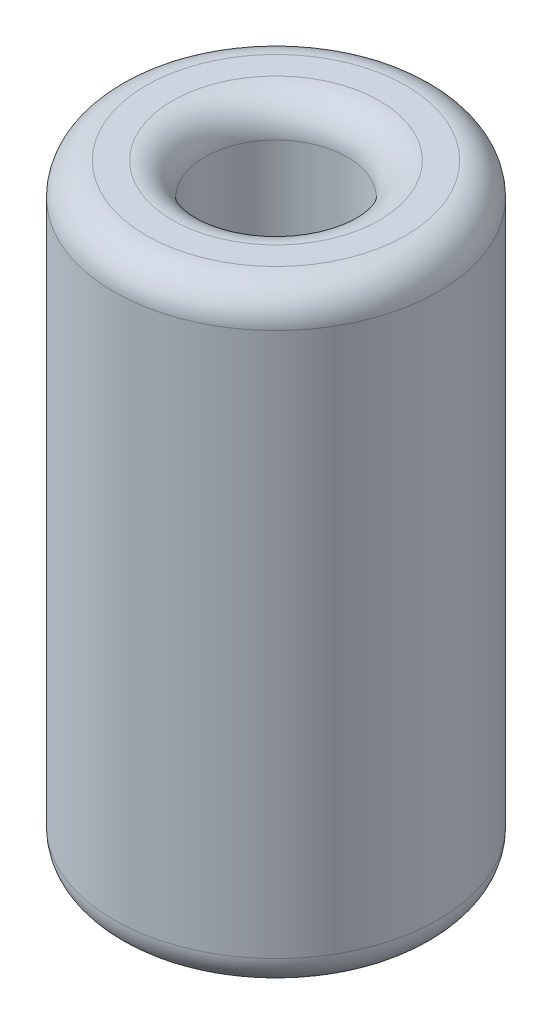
SolidWorks part; units mm, degrees
ref_plane "Front Plane" through (0, 0, 0) normal (0, 0, 1) x (1, 0, 0)
ref_plane "Top Plane" through (0, 0, 0) normal (0, 1, 0) x (1, 0, 0)
ref_plane "Right Plane" through (0, 0, 0) normal (1, 0, 0) x (0, 0, -1)
sketch "Sketch1" plane through (0, 0, 0) normal (0, 0, 1) x (1, 0, 0)
  line L0 (0, 0) -> (0, 10.5306) construction
  line L2 (2.55, 15) -> (3.2, 15)
  line L3 (1.75, 14.2) -> (1.75, 0.8)
  line L4 (2.55, 0) -> (3.2, 0)
  line L5 (4, 14.2) -> (4, 0.8)
  arc A0 (4, 0.8) -> (3.2, 0) centre (3.2, 0.8) cw
  arc A1 (2.55, 0) -> (1.75, 0.8) centre (2.55, 0.8) cw
  arc A2 (2.55, 15) -> (1.75, 14.2) centre (2.55, 14.2) ccw
  arc A3 (4, 14.2) -> (3.2, 15) centre (3.2, 14.2) ccw
  dimension "D4" = 0.8
  dimension "D1" = 8
  dimension "D2" = 3.5
  dimension "D3" = 15
revolve "Revolve1" add sketch "Sketch1" angle 360 about L0
